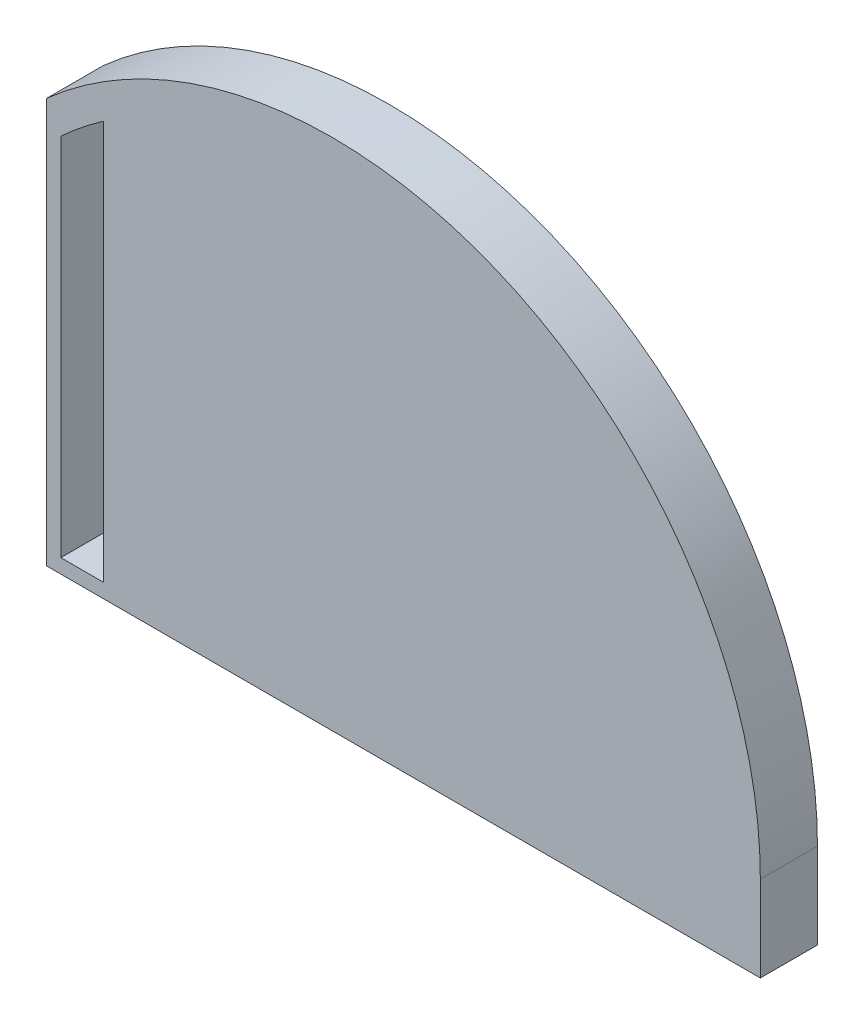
SolidWorks part; units mm, degrees
ref_plane "Front" through (0, 0, 0) normal (0, 0, 1) x (1, 0, 0)
ref_plane "Top" through (0, 0, 0) normal (0, 1, 0) x (1, 0, 0)
ref_plane "Right" through (0, 0, 0) normal (1, 0, 0) x (0, 0, -1)
sketch "Sketch1" plane through (0, 0, 0) normal (0, 0, 1) x (1, 0, 0)
  line L0 (0, 0) -> (250, 0)
  line L1 (250, 0) -> (250, 30)
  line L2 (0, 141.8034) -> (0, 0)
  arc A0 (250, 30) -> (0, 141.8034) centre (100, 30) ccw
  dimension "D1" = 150
  dimension "D2" = 30
  dimension "D3" = 250
extrude "Extrude1" add sketch "Sketch1" along normal blind 20
sketch "Sketch2" plane through (0, 0, 20) normal (0, 0, 1) x (1, 0, 0)
  line L0 (5, 132.8348) -> (5, 5)
  line L1 (5, 5) -> (20, 5)
  line L2 (20, 5) -> (20, 144.8913)
  line L3 (0, 0) -> (250, 0) construction
  line L4 (0, 141.8034) -> (0, 0) construction
  arc A2 (240, 30) -> (6.6667, 134.3498) centre (100, 30) ccw
  arc A3 (20, 144.8913) -> (5, 132.8348) centre (100, 30) ccw
  dimension "D2" = 5
  dimension "D3" = 5
  dimension "D4" = 15
  dimension "D1" = 10
extrude "Cut-Extrude3" cut sketch "Sketch2" against normal through all
